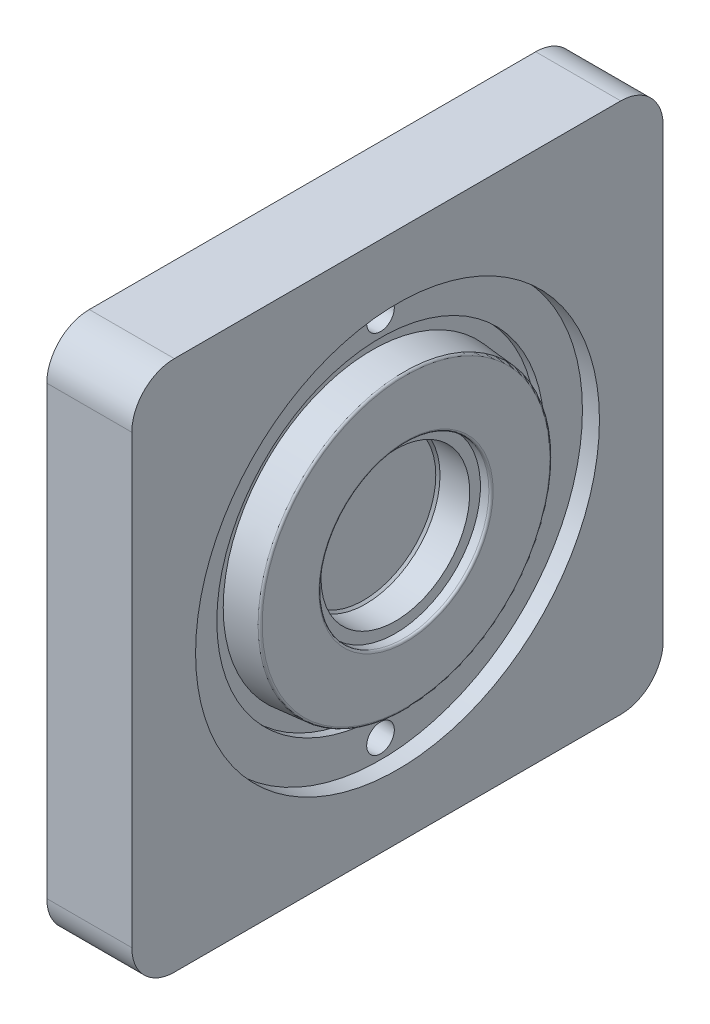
SolidWorks part; units mm, degrees
other "<Pump Coupling Pattern>-<Boss-Extrude1>"
ref_plane "Front Plane" through (0, 0, 0) normal (0, 0, 1) x (1, 0, 0)
ref_plane "Top Plane" through (0, 0, 0) normal (0, 1, 0) x (1, 0, 0)
ref_plane "Right Plane" through (0, 0, 0) normal (1, 0, 0) x (0, 0, -1)
other "Bounding Box"
ref_plane "Default Plane" through (20, -125, -125) normal (0, 1, 0) x (1, 0, 0)
body saved out of another part "Stock-Pump Coupling-1"
sketch "Sketch1" plane through (8, 0, 0) normal (1, 0, 0) x (0, 0, -1)
  line L0 (-125, 0) -> (125, 0) construction
  line L1 (-125, -125) -> (-125, 125) construction
  line L2 (125, 125) -> (125, -125) construction
  line L3 (0, 0) -> (0, 86.5) construction
  circle A0 centre (0, 86.5) radius 7.5
  circle A1 centre (0, -86.5) radius 7.5
  dimension "D1" = 15
  dimension "D2" = 86.5
extrude "Cut-Extrude1" [suppressed] cut sketch "Sketch1" against normal through all draft 10
inserted part "Pump Coupling Pattern"
move or copy body "Body-Move/Copy2" placed by mates yes
combine bodies "Combine1" operation type subtract main body 101 bodies to subtract 103
fillet "Fillet1" radius 20 4 edges at (-4, -125, 125) (-4, -125, -125) (-4, 125, -125) (-4, 125, 125)
